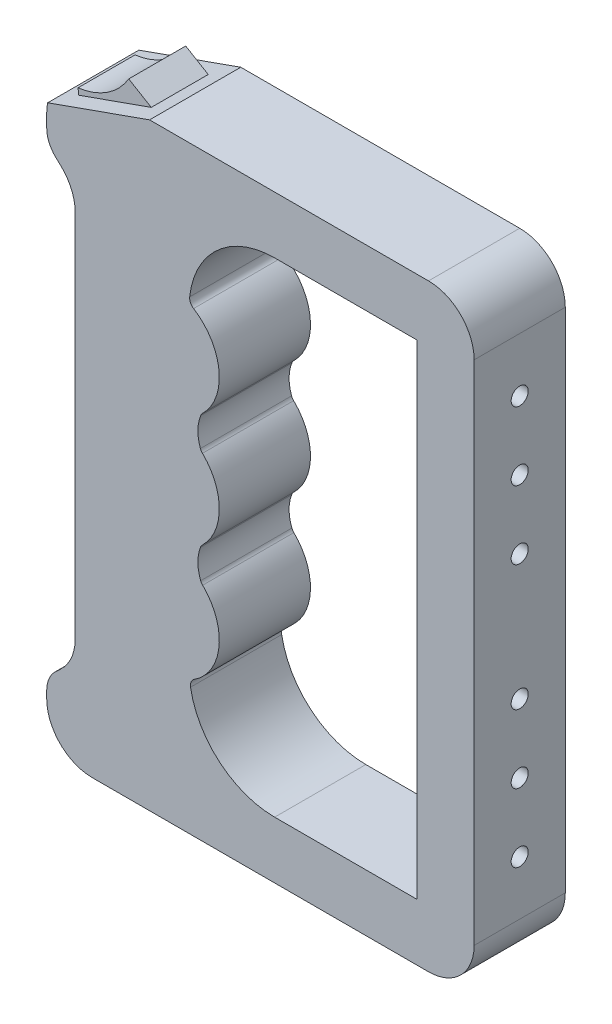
SolidWorks part; units mm, degrees
ref_plane "Plan de face" through (0, 0, 0) normal (0, 0, 1) x (1, 0, 0)
ref_plane "Plan de dessus" through (0, 0, 0) normal (0, 1, 0) x (1, 0, 0)
ref_plane "Plan de droite" through (0, 0, 0) normal (1, 0, 0) x (0, 0, -1)
sketch "Esquisse1" plane through (0, 0, 0) normal (0, 0, 1) x (1, 0, 0)
  line L0 (-100.0317, -13.7507) -> (51.603, -13.7507) construction
  line L1 (-51.1441, 39.2493) -> (-2.1969, 39.2493)
  line L2 (-69.1969, 31.2493) -> (-69.1969, 28.9716)
  line L3 (-61.1969, -65.7507) -> (-2.1969, -65.7507)
  line L4 (5.8031, 31.2493) -> (5.8031, -57.7507)
  line L5 (-64.1969, 44.8919) -> (-64.1969, -73.5501) construction
  line L6 (-67.605, 25.313) -> (-66.7441, 24.5111)
  line L7 (-67.605, -52.8144) -> (-66.7441, -52.0125)
  line L8 (-69.1969, -56.473) -> (-69.1969, -57.7507)
  line L9 (-64.1969, 18.6574) -> (-64.1969, -46.1588)
  line L10 (-69.0225, 32.911) -> (-51.1441, 39.2493)
  line L12 (-29.1969, 29.2493) -> (-4.1969, 29.2493)
  line L14 (-29.1969, -55.7507) -> (-4.1969, -55.7507)
  line L15 (-4.1969, 29.2493) -> (-4.1969, -55.7507)
  line L16 (-64.1969, 64.8919) -> (-64.1969, -53.5501) construction
  line L17 (-44.5372, -3.7822) -> (-28.5747, -3.7822) construction
  arc A0 (-69.1969, -57.7507) -> (-61.1969, -65.7507) centre (-61.1969, -57.7507) ccw
  arc A1 (-69.0225, 32.911) -> (-69.1969, 31.2493) centre (-61.1969, 31.2493) ccw
  arc A2 (-66.7441, -52.0125) -> (-64.1969, -46.1588) centre (-72.1969, -46.1588) ccw
  arc A3 (-66.7441, 24.5111) -> (-64.1969, 18.6574) centre (-72.1969, 18.6574) cw
  arc A4 (-67.605, -52.8144) -> (-69.1969, -56.473) centre (-64.1969, -56.473) ccw
  arc A5 (-67.605, 25.313) -> (-69.1969, 28.9716) centre (-64.1969, 28.9716) cw
  arc A6 (-2.1969, -65.7507) -> (5.8031, -57.7507) centre (-2.1969, -57.7507) ccw
  arc A7 (-2.1969, 39.2493) -> (5.8031, 31.2493) centre (-2.1969, 31.2493) cw
  arc A8 (-43.9637, -43.3855) -> (-29.1969, -55.7507) centre (-29.1969, -40.7507) ccw
  arc A9 (-29.1969, 29.2493) -> (-44.1095, 15.8666) centre (-29.1969, 14.2493) ccw
  arc A10 (-41.8635, -20.7139) -> (-41.8635, -6.7875) centre (-48.6022, -13.7507) ccw
  arc A11 (-41.8297, -0.6811) -> (-43.4204, 14.4374) centre (-48.6022, 6.2493) ccw
  arc A12 (-41.8297, -26.8203) -> (-43.3068, -41.8658) centre (-48.6022, -33.7507) cw
  arc A13 (-43.4204, 14.4374) -> (-44.1095, 15.8666) centre (-42.6182, 15.7049) cw
  arc A14 (-43.3068, -41.8658) -> (-43.9637, -43.3855) centre (-42.487, -43.122) ccw
  arc A15 (-42.1751, -1.1993) -> (-41.8297, -0.6811) centre (-40.7814, -1.7539) cw
  arc A16 (-42.2247, -6.2366) -> (-41.8635, -6.7875) centre (-40.8204, -5.7096) ccw
  arc A17 (-42.1751, -26.3021) -> (-42.2247, -21.2648) centre (-35.6842, -23.7192) cw
  arc A18 (-42.1751, -26.3021) -> (-41.8297, -26.8203) centre (-40.7814, -25.7475) ccw
  arc A19 (-42.1751, -1.1993) -> (-42.2247, -6.2366) centre (-35.6842, -3.7822) ccw
  arc A20 (-41.8635, -20.7139) -> (-42.2247, -21.2648) centre (-40.8204, -21.7918) ccw
  point P18 (-64.1969, -49.6398)
  point P21 (-64.1969, 22.1384)
  point P24 (-69.1969, -54.2974)
  point P57 (-44.1969, -22.3815)
  dimension "D5" = 8
  dimension "D6" = 8
  dimension "D7" = 5
  dimension "D8" = 8
  dimension "D13" = 15
  dimension "D15" = 1.5
  dimension "D12" = 1.5
  dimension "D1" = 105
  dimension "D2" = 75
  dimension "D3" = 52
  dimension "D4" = 5
  dimension "D9" = 10
  dimension "D10" = 10
  dimension "D11" = 10
  dimension "D14" = 2
extrude "Boss.-Extru.1" add sketch "Esquisse1" along normal mid plane 16
sketch "Esquisse2" plane through (0, 0, 0) normal (0, 0, 1) x (1, 0, 0)
  line L0 (-66.7033, 34.8433) -> (-66.0121, 29.207)
  line L1 (-57.8057, 40.6434) -> (-51.721, 37.0172)
  line L2 (-66.0121, 29.207) -> (-51.721, 37.0172)
  arc A0 (-66.7033, 34.8433) -> (-57.8057, 40.6434) centre (-68.1723, 46.8215) ccw
extrude "Boss.-Extru.2" add sketch "Esquisse2" along normal mid plane 10
sketch "Esquisse3" plane through (5.8031, 0, 0) normal (1, 0, 0) x (0, 0, -1)
  line L0 (0, 43.2227) -> (0, -69.5928) construction
  line L1 (-40.0607, -13.2507) -> (28.1337, -13.2507) construction
  line L2 (-8, 39.2493) -> (8, 39.2493) construction
  circle A0 centre (0, -24.2702) radius 1.5
  circle A1 centre (0, -36.2702) radius 1.5
  circle A2 centre (0, -48.2702) radius 1.5
  circle A3 centre (0, 21.7688) radius 1.5
  circle A4 centre (0, 9.7688) radius 1.5
  circle A5 centre (0, -2.2312) radius 1.5
  dimension "D2" = 3
  dimension "D1" = 52.5
extrude "Enlèv. mat.-Extru.1" cut sketch "Esquisse3" against normal blind 5
sketch "Esquisse5" plane through (0, -65.7507, 0) normal (0, -1, 0) x (1, 0, 0)
  line L0 (-74.0792, 0) -> (-8.958, 0) construction
  line L2 (-56.2184, 2) -> (-52.4946, 2)
  line L3 (-56.2184, 2) -> (-56.2184, -2)
  line L4 (-56.2184, -2) -> (-52.4946, -2)
  line L5 (-52.4946, 2) -> (-52.4946, -2)
  circle A0 centre (-58.6855, 0) radius 2
extrude "Enlèv. mat.-Extru.2" cut sketch "Esquisse5" against normal blind 18
